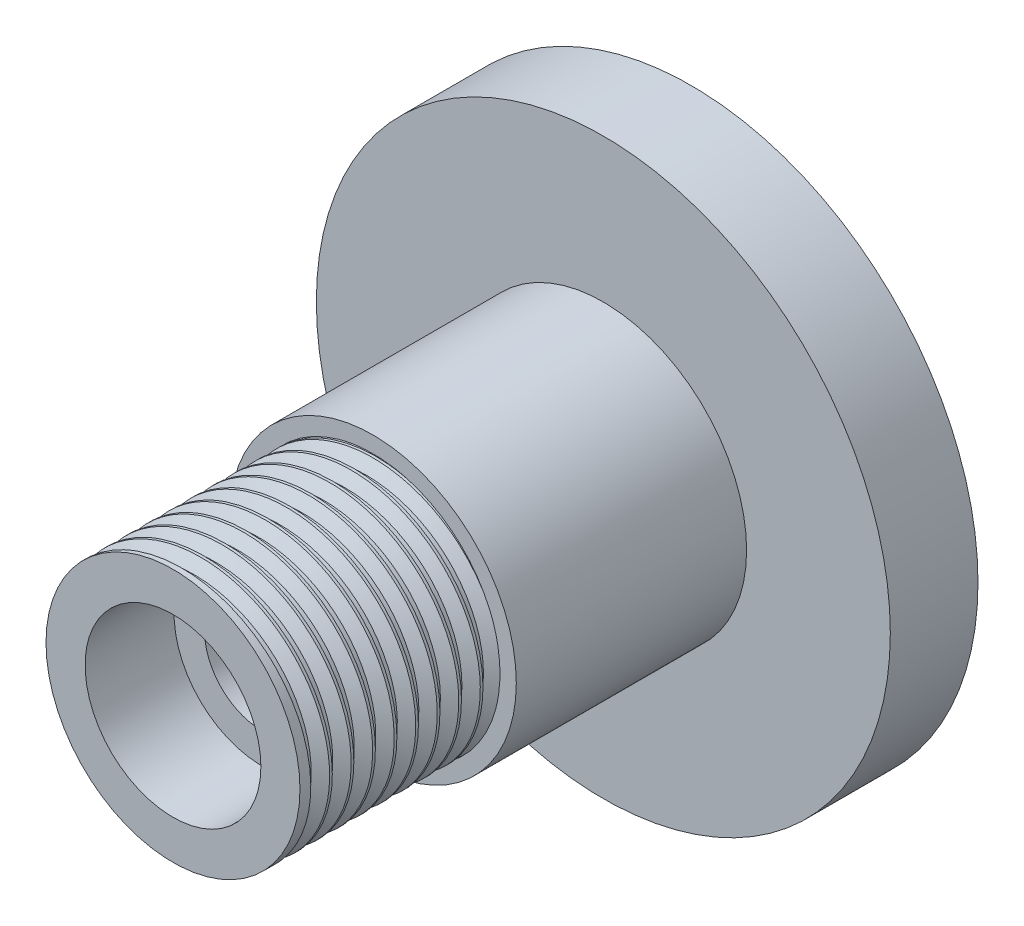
SolidWorks part; units mm, degrees
ref_plane "Front Plane" through (0, 0, 0) normal (0, 0, 1) x (1, 0, 0)
ref_plane "Top Plane" through (0, 0, 0) normal (0, 1, 0) x (1, 0, 0)
ref_plane "Right Plane" through (0, 0, 0) normal (1, 0, 0) x (0, 0, -1)
sketch "Sketch1" plane through (0, 0, 0) normal (0, 0, 1) x (1, 0, 0)
  circle A0 centre (0, 0) radius 20
  dimension "D1" = 40
extrude "Boss-Extrude1" add sketch "Sketch1" along normal blind 36.1
sketch "Sketch2" plane through (0, 0, 36.1) normal (0, 0, 1) x (1, 0, 0)
  circle A0 centre (0, 0) radius 8.85
  circle A1 centre (0, 0) radius 20 construction
  circle A2 centre (0, 0) radius 20
  dimension "D1" = 17.7
extrude "Cut-Extrude1" cut sketch "Sketch2" against normal blind 13.94
sketch "Sketch5" plane through (0, 0, 22.16) normal (0, 0, 1) x (1, 0, 0)
  circle A0 centre (0, 0) radius 9.985
  circle A1 centre (0, 0) radius 20 construction
  circle A2 centre (0, 0) radius 20
  dimension "D1" = 19.97
extrude "Cut-Extrude2" cut sketch "Sketch5" against normal blind 16.05
thread "Thread1" pitch 1.5 start angle 0, offset 0, length 0, pitch 1.5, diameter 17.7
ref_plane "Plane1" through (-8.85, 0, 36.1) normal (0, -1, 0) x (-1, 0, 0)
sketch "Thread Profile1" plane through (-8.85, 0, 36.1) normal (0, -1, 0) x (-1, 0, 0)
  line L0 (0, 0) -> (0, 1.5) construction
  line L11 (0, 0) -> (0, 1.3125)
  line L12 (0, 1.3125) -> (-0.8119, 0.8437)
  line L13 (-0.8119, 0.8437) -> (-0.8119, 0.4687)
  line L15 (-0.8119, 0.4687) -> (0, 0)
  line L17 (-0.8119, 0.6562) -> (0, 0.6562) construction
  point P2 (0, 0)
  dimension "Pitch" = 1.5
  dimension "Profile_Angle" = 60
  dimension "Profile_Land" = 0.375
  dimension "Profile_Height" = 0.8119
sketch "Sketch11" plane through (0, 0, 36.1) normal (0, 0, 1) x (1, 0, 0)
  circle A0 centre (0, 0) radius 6.125
  dimension "D1" = 12.25
extrude "Cut-Extrude3" cut sketch "Sketch11" against normal blind 6.2
sketch "Sketch12" plane through (0, 0, 0) normal (0, 0, -1) x (-1, 0, 0)
  circle A0 centre (0, 0) radius 6.9
  dimension "D1" = 13.8
ref_plane "Plane2" through (0, 0, 21) normal (0, 0, -1) x (-1, 0, 0)
sketch "Sketch13" plane through (0, 0, 21) normal (0, 0, -1) x (-1, 0, 0)
  circle A0 centre (0, 0) radius 5
  dimension "D1" = 10
loft "Cut-Loft1" cut profiles "Sketch13", "Sketch12"
sketch "Sketch14" plane through (0, 0, 29.9) normal (0, 0, 1) x (1, 0, 0)
  circle A0 centre (0, 0) radius 4
  dimension "D1" = 8
extrude "Cut-Extrude4" cut sketch "Sketch14" against normal up to next
thread "Thread2" pitch 1.25 start angle 0, offset 0, length 0, pitch 1.25, diameter 8
ref_plane "Plane3" through (-4, 0, 29.9) normal (0, -1, 0) x (-1, 0, 0)
sketch "Thread Profile2" plane through (-4, 0, 29.9) normal (0, -1, 0) x (-1, 0, 0)
  line L0 (0, 0) -> (0, 1.25) construction
  line L1 (0, 0) -> (0.6766, 0.3906)
  line L2 (0.6766, 0.3906) -> (0.6766, 0.5469)
  line L3 (0.6766, 0.5469) -> (0, 0.9375)
  line L4 (0.6766, 0.4687) -> (0, 0.4687) construction
  line L11 (0, 0) -> (0, 0.9375)
  point P2 (0, 0)
  dimension "Pitch" = 1.25
  dimension "Profile_Angle" = 60
  dimension "Profile_Land" = 0.1562
  dimension "Profile_Height" = 0.6766
